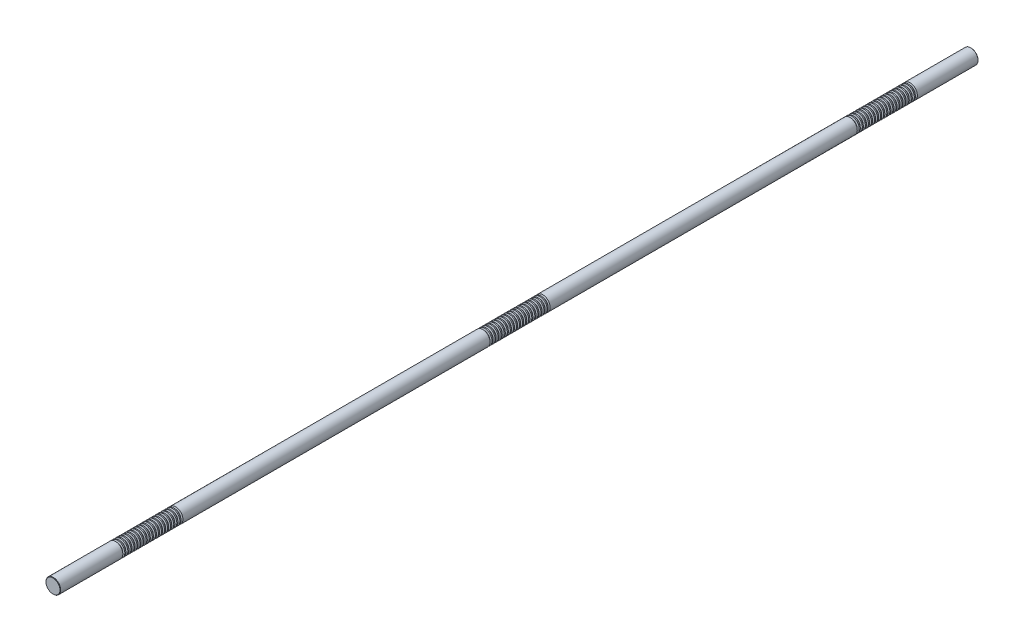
SolidWorks part; units mm, degrees
ref_plane "Front Plane" through (0, 0, 0) normal (0, 0, 1) x (1, 0, 0)
ref_plane "Top Plane" through (0, 0, 0) normal (0, 1, 0) x (1, 0, 0)
ref_plane "Right Plane" through (0, 0, 0) normal (1, 0, 0) x (0, 0, -1)
sketch "Sketch1" plane through (0, 0, 0) normal (0, 0, 1) x (1, 0, 0)
  circle A0 centre (0, 0) radius 12
  dimension "D1" = 24
extrude "Boss-Extrude1" add sketch "Sketch1" along normal mid plane 1500
chamfer "Chamfer1" distance 0.6 angle 45 2 edges at (12, 0, -750) (12, 0, 750)
sketch "Sketch2" plane through (0, 0, 0) normal (1, 0, 0) x (0, 0, -1)
  line L0 (650.3684, 12) -> (647.1316, 12)
  line L1 (749.4, 12) -> (-749.4, 12) construction
  line L2 (647.1316, 12) -> (647.8684, 9.25)
  line L3 (647.8684, 9.25) -> (649.6316, 9.25)
  line L4 (649.6316, 9.25) -> (650.3684, 12)
  line L5 (750, -11.4) -> (750, 11.4) construction
  point P4 (648.75, 12)
  point P7 (648.75, 9.25)
  point P8 (650, 10.625)
  point P9 (647.5, 10.625)
  dimension "D1" = 2.5
  dimension "D2" = 100
  dimension "D3" = 2.75
  dimension "D4" = 30
revolve "Cut-Revolve1" cut sketch "Sketch2" angle 360 about axis through (0, 0, 750) along (0, 0, -1)
pattern_linear "LPattern1" count 20 spacing 5 along (0, 0, 1) of "Cut-Revolve1"
pattern_linear "LPattern2" count 3 spacing 600 along (0, 0, 1) of "Cut-Revolve1", "LPattern1"
